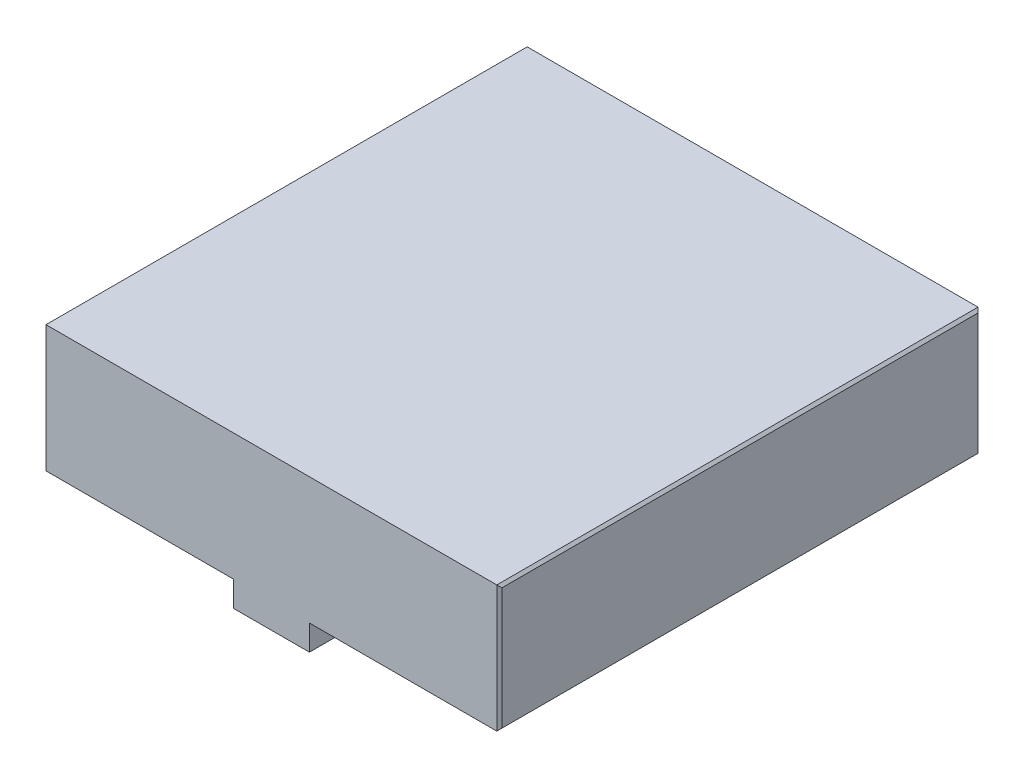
SolidWorks part; units mm, degrees
ref_plane "Face" through (0, 0, 0) normal (0, 0, 1) x (1, 0, 0)
ref_plane "Dessus" through (0, 0, 0) normal (0, 1, 0) x (1, 0, 0)
ref_plane "Droite" through (0, 0, 0) normal (1, 0, 0) x (0, 0, -1)
sketch "Esquisse1" plane through (0, 0, 0) normal (0, 0, 1) x (1, 0, 0)
  line L0 (-7.5, 0) -> (7.5, 0)
  line L1 (7.5, 0) -> (7.5, 5)
  line L2 (7.5, 5) -> (45, 5)
  line L3 (45, 5) -> (45, 30)
  line L4 (45, 30) -> (-45, 30)
  line L5 (-45, 30) -> (-45, 5)
  line L6 (-45, 5) -> (-7.5, 5)
  line L7 (-7.5, 5) -> (-7.5, 0)
  dimension "D1" = 15
  dimension "D2" = 90
  dimension "D3" = 25
  dimension "D4" = 5
extrude "Extrusion1" add sketch "Esquisse1" along normal blind 95
chamfer "Chanfrein1" distance 0.5 angle 45 8 edges at (-45, 5, 47.5) (-45, 30, 47.5) (45, 30, 47.5) (45, 5, 47.5) (45, 17.5, 95) (-45, 17.5, 95) (-45, 17.5, 0) (45, 17.5, 0)
